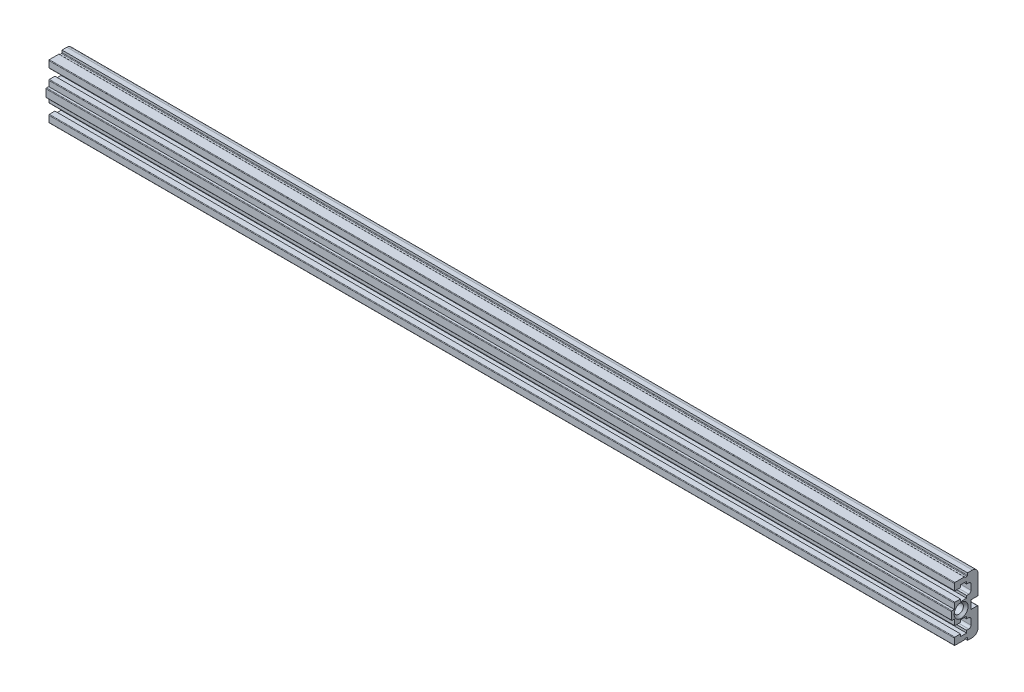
SolidWorks part; units mm, degrees
other "1"
ref_plane "前视基准面" through (0, 0, 0) normal (0, 0, 1) x (1, 0, 0)
ref_plane "上视基准面" through (0, 0, 0) normal (0, 1, 0) x (1, 0, 0)
ref_plane "右视基准面" through (0, 0, 0) normal (1, 0, 0) x (0, 0, -1)
imported_body "输入1"
sketch "草图1" plane through (0, 0, 8.75) normal (0, 0, -1) x (-1, 0, 0)
  line L0 (-215.9, -8.2) -> (-215.9, -1.4) construction
  line L1 (215.9, 5.0674) -> (109.22, 5.0674)
  line L2 (215.9, 5.0674) -> (215.9, -25.3677)
  line L3 (215.9, -25.3677) -> (109.22, -25.3677)
  line L4 (109.22, 5.0674) -> (109.22, -25.3677)
  line L5 (215.9, -1.4) -> (215.9, -8.2) construction
  dimension "D1" = 325.12
extrude "切除-拉伸1" cut sketch "草图1" against normal through all
sketch "草图2" plane through (-109.22, 0, 0) normal (-1, 0, 0) x (0, 0, 1)
  circle A0 centre (14.8, -9.9) radius 1.65
extrude "切除-拉伸2" cut sketch "草图2" against normal blind 15.02
chamfer "倒角1" distance 0.85 angle 45 1 edges at (-109.22, -9.9, 16.45)
